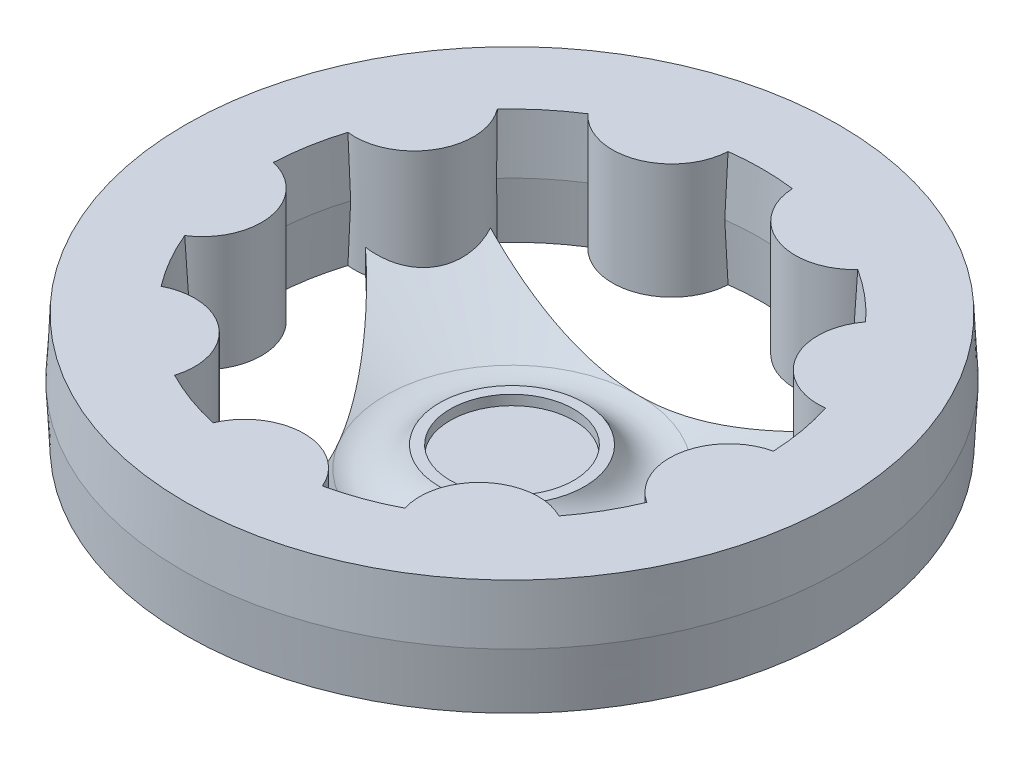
SolidWorks part; units mm, degrees
ref_plane "Front Plane" through (0, 0, 0) normal (0, 0, 1) x (1, 0, 0)
ref_plane "Top Plane" through (0, 0, 0) normal (0, 1, 0) x (1, 0, 0)
ref_plane "Right Plane" through (0, 0, 0) normal (1, 0, 0) x (0, 0, -1)
sketch "Sketch1" plane through (0, 0, 0) normal (0, 0, 1) x (1, 0, 0)
  line L0 (0, 0) -> (0, 45.9521) construction
  line L1 (0, 0) -> (16, 0)
  line L2 (16, 0) -> (16, -12.8)
  line L3 (16, -12.8) -> (17.6, -14.4)
  line L4 (17.6, -14.4) -> (17.6, -16)
  line L5 (17.6, -16) -> (16, -16)
  line L6 (16, -16) -> (16, -30.4)
  line L7 (15.4, -31) -> (3.6, -31)
  line L8 (0, -7.75) -> (0, 0)
  line L9 (0, -7.75) -> (3, -9.4821)
  line L10 (3, -9.4821) -> (3, -30.4)
  line L11 (3, -30.4) -> (3.6, -31)
  line L12 (16, -30.4) -> (15.4, -31)
  point P9 (16, -31)
  point P13 (3, -31)
revolve "Revolve1" add sketch "Sketch1" angle 360 about L0
sketch "Sketch2" plane through (0, 0, 0) normal (0, 0, 1) x (1, 0, 0)
  line L0 (16, 0) -> (-16, 0) construction
  line L1 (16, -12.8) -> (16, 0) construction
  line L2 (17.6, -14.4) -> (16, -12.8) construction
  line L3 (17.6, -16) -> (17.6, -14.4) construction
  line L4 (16, 0) -> (15, 0)
  line L5 (16, -12.8) -> (16, 0)
  line L6 (17.6, -14.4) -> (16, -12.8)
  line L7 (17.6, -16) -> (17.6, -14.4)
  line L8 (15, 0) -> (15, 2.4)
  line L9 (15, 2.4) -> (17.6, 2.4)
  line L10 (17.6, -16) -> (19.2, -16)
  line L11 (19.2, -16) -> (19.2, -15.9488)
  line L12 (22.4312, -11.1584) -> (57.4299, 2.982)
  line L13 (64.2, 2) -> (64.2, 25.8)
  line L14 (64.2, 25.8) -> (75.8, 25.8)
  line L15 (75.8, 25.8) -> (75.8, 2)
  line L16 (75.8, 2) -> (79.2663, 2)
  line L17 (80, 2) -> (80, 30) construction
  line L18 (79.2663, 30) -> (60.7337, 30)
  line L19 (60, 30) -> (60, 2) construction
  line L20 (60, 2) -> (64.2, 2)
  line L21 (0, 0) -> (0, -29.5318) construction
  line L22 (-15.4, -31) -> (15.4, -31) construction
  line L23 (30.7445, -2.6226) -> (60, 9.1974)
  line L24 (80, 16) -> (79.2663, 30)
  line L25 (80, 16) -> (79.2663, 2)
  line L26 (80, 16) -> (60, 16) construction
  line L27 (60, 16) -> (60.7337, 30)
  line L28 (60, 16) -> (60, 9.1974)
  line L29 (17.6, 2.4) -> (17.6, -7.9333) construction
  line L30 (17.6, -7.9333) -> (30.7445, -2.6226) construction
  line L31 (57.4299, 2.982) -> (60, 4.0204) construction
  arc A0 (60, 2) -> (57.4299, 2.982) centre (58.1868, 1.1087) ccw
  arc A1 (17.6, 2.4) -> (30.7445, -2.6226) centre (26.8736, 6.9583) ccw
  arc A2 (22.4312, -11.1584) -> (19.2, -15.9488) centre (24.3667, -15.9488) ccw
  point P30 (19.2, -12.4639)
revolve "Revolve2" add sketch "Sketch2" angle 360 about L21
sketch "Sketch3" plane through (0, 30, 0) normal (0, 1, 0) x (1, 0, 0)
  line L0 (0, 0) -> (0, 72.8617) construction
  line L1 (0, 0) -> (68.2353, 39.3957) construction
  line L2 (0, 0) -> (-63.5801, 36.708) construction
  line L3 (0, 0) -> (45.9627, 38.5673) construction
  line L4 (0, 0) -> (-45.9627, 38.5673) construction
  arc A2 (45.9627, 38.5673) -> (-45.9627, 38.5673) centre (0, 0) ccw
  arc A3 (-45.9627, 38.5673) -> (45.9627, 38.5673) centre (0, 169.6835) ccw
  circle A4 centre (0, 0) radius 30.7445 construction
  circle A5 centre (0, 0) radius 60 construction
  dimension "D1" = 120
  dimension "D2" = 10
extrude "Extrude1" cut sketch "Sketch3" against normal through all
pattern_circular "CirPattern1" count 3 over 360 about axis through (0, 0, 0) along (0, 1, 0) of "Extrude1"
ref_plane "Plane2" through (0, 16, 0) normal (0, 1, 0) x (-1, 0, 0)
draft "Draft5" type of draft neutral plane draft angle 3 neutral plane "Plane2" faces to draft 1 parameters "D1"=3
sketch "Sketch5" plane through (0, 30, 0) normal (0, 1, 0) x (1, 0, 0)
  line L0 (0, -60.7337) -> (0, -79.2663) construction
  circle A0 centre (0, 0) radius 60.7337 construction
  circle A1 centre (0, 0) radius 79.2663 construction
  arc A2 (13.2668, -59.267) -> (-13.2668, -59.267) centre (0, -64.8663) ccw
  arc A3 (-13.2668, -59.267) -> (13.2668, -59.267) centre (0, 0) ccw
  arc A4 (-13.2668, -59.267) -> (13.2668, -59.267) centre (0, -64.8663) ccw construction
  dimension "D1" = 14.4
extrude "Extrude2" add sketch "Sketch5" against normal up to surface (28 mm away)
pattern_circular "CirPattern2" count 9 over 360 about axis through (0, 0, 0) along (0, 1, 0) of "Extrude2"
sketch "Sketch6" plane through (0, 25.8, 0) normal (0, -1, 0) x (1, 0, 0)
  circle A1 centre (0, 64.8663) radius 14.4
  arc A2 (-13.2668, 59.267) -> (-9.6203, 54.1514) centre (0, 64.8663) ccw construction
extrude "Extrude3" add sketch "Sketch6" along normal up to surface (23.8 mm away)
sketch "Sketch9" plane through (0, 0, 0) normal (1, 0, 0) x (0, 0, -1)
  line L0 (-64.8663, 5.64) -> (-64.8663, -17.9981) construction
  line L1 (-64.8663, 2) -> (-64.8663, 30) construction
  line L2 (-58.8663, 2) -> (-58.8663, 5)
  line L3 (-59.267, 2) -> (-54.1514, 2) construction
  line L4 (-58.8663, 5) -> (-61.8663, 8)
  line L5 (-61.8663, 8) -> (-61.8663, 12)
  line L6 (-61.8663, 12) -> (-64.8663, 12)
  line L7 (-64.8663, 12) -> (-64.8663, 2)
  line L8 (-75.1231, 2) -> (-62.6051, 2) construction
  line L9 (-64.8663, 2) -> (-58.8663, 2)
  dimension "D1" = 45
  dimension "D2" = 12
  dimension "D3" = 3
  dimension "D4" = 3
  dimension "D5" = 4
revolve "Cut-Revolve1" cut sketch "Sketch9" angle 360 about L0
equation "\"D3@Sketch1\" = \"D2@Sketch1\"*.05"
equation "\"D8@Sketch1\" = \"D5@Sketch1\"*0.75"
equation "\"D9@Sketch1\" = \"D6@Sketch1\"*0.1"
equation "\"D12@Sketch1\" = \"D9@Sketch1\""
equation "\"D10@Sketch1\" = \"D9@Sketch1\""
equation "\"D11@Sketch1\" = \"D9@Sketch1\""
equation "\"D4@Sketch2\" = \"D3@Sketch2\"*0.15"
equation "\"D5@Sketch2\" = \"D4@Sketch2\""
equation "\"D8@Sketch2\" = \"D5@Sketch2\""
equation "\"D12@Sketch2\" = \"D6@Sketch2\"*0.06"
equation "\"D1@Sketch2\" = \"D3@Sketch1\""
equation "\"D15@Sketch2\" = \"D9@Sketch2\""
equation "\"D17@Sketch2\" = \"D9@Sketch2\"*0.5"
equation "\"D11@Sketch2\" = \"D22@Sketch2\""
